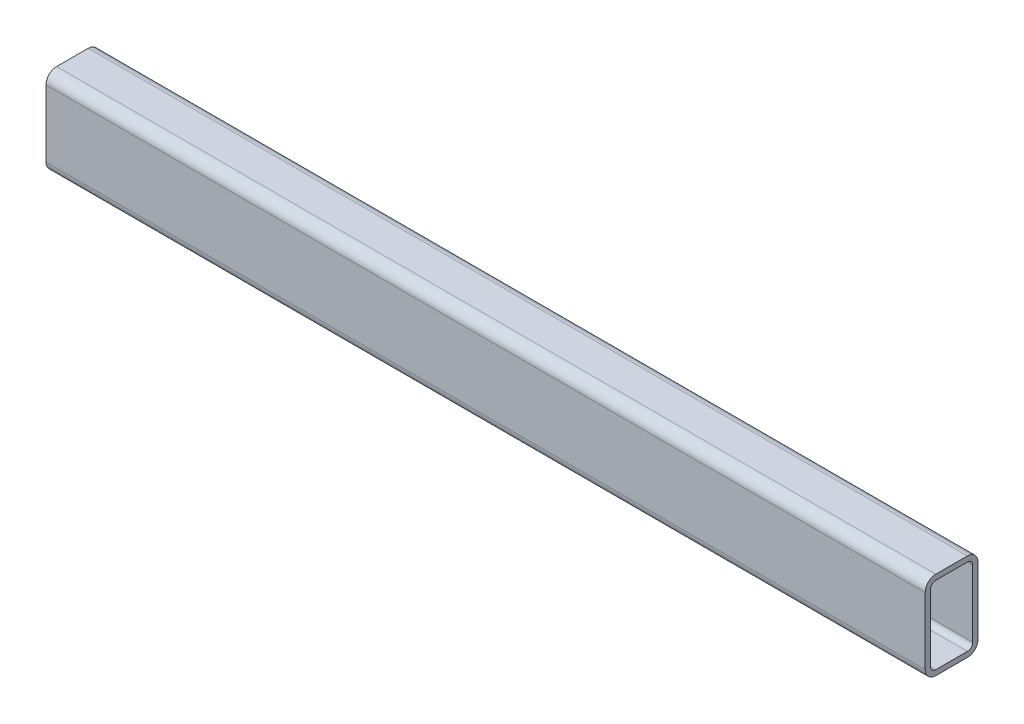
SolidWorks part; units mm, degrees
ref_plane "Ebene vorne" through (0, 0, 0) normal (0, 0, 1) x (1, 0, 0)
ref_plane "Ebene oben" through (0, 0, 0) normal (0, 1, 0) x (1, 0, 0)
ref_plane "Ebene rechts" through (0, 0, 0) normal (1, 0, 0) x (0, 0, -1)
sketch "Skizze1" plane through (0, 0, 0) normal (0, 0, 1) x (1, 0, 0)
  line L0 (-250, 0) -> (250, 0)
  dimension "D1" = 500
other "Strukturbauteil1"
ref_plane "Ebene1" through (-250, 0, 0) normal (1, 0, 0) x (0, 0, -1)
sketch "Skizze12" plane through (-250, 0, 0) normal (1, 0, 0) x (0, 0, -1)
  line L0 (-15, -25) -> (15, 25) construction
  line L1 (-9, -25) -> (9, -25)
  line L2 (-15, -19) -> (-15, 19)
  line L3 (-9, 25) -> (9, 25)
  line L4 (15, -19) -> (15, 19)
  line L5 (-15, 0) -> (15, 0) construction
  line L6 (0, 25) -> (0, -25) construction
  line L7 (-12, -19) -> (-12, 19)
  line L8 (-9, 22) -> (9, 22)
  line L9 (12, -19) -> (12, 19)
  line L10 (-9, -22) -> (9, -22)
  line L11 (-15, -25) -> (15, -25) construction
  line L12 (15, -25) -> (15, 25) construction
  line L13 (15, 25) -> (-15, 25) construction
  line L14 (-15, 25) -> (-15, -25) construction
  arc A0 (-15, 19) -> (-9, 25) centre (-9, 19) cw
  arc A1 (-9, -25) -> (-15, -19) centre (-9, -19) cw
  arc A2 (9, -25) -> (15, -19) centre (9, -19) ccw
  arc A3 (9, 25) -> (15, 19) centre (9, 19) cw
  arc A4 (-12, 19) -> (-9, 22) centre (-9, 19) cw
  arc A5 (9, 22) -> (12, 19) centre (9, 19) cw
  arc A6 (9, -22) -> (12, -19) centre (9, -19) ccw
  arc A7 (-9, -22) -> (-12, -19) centre (-9, -19) cw
  point P6 (-15, 25)
  point P31 (0, 0)
  dimension "D3" = 6
  dimension "D1" = 30
  dimension "D2" = 50
  dimension "D4" = 3
